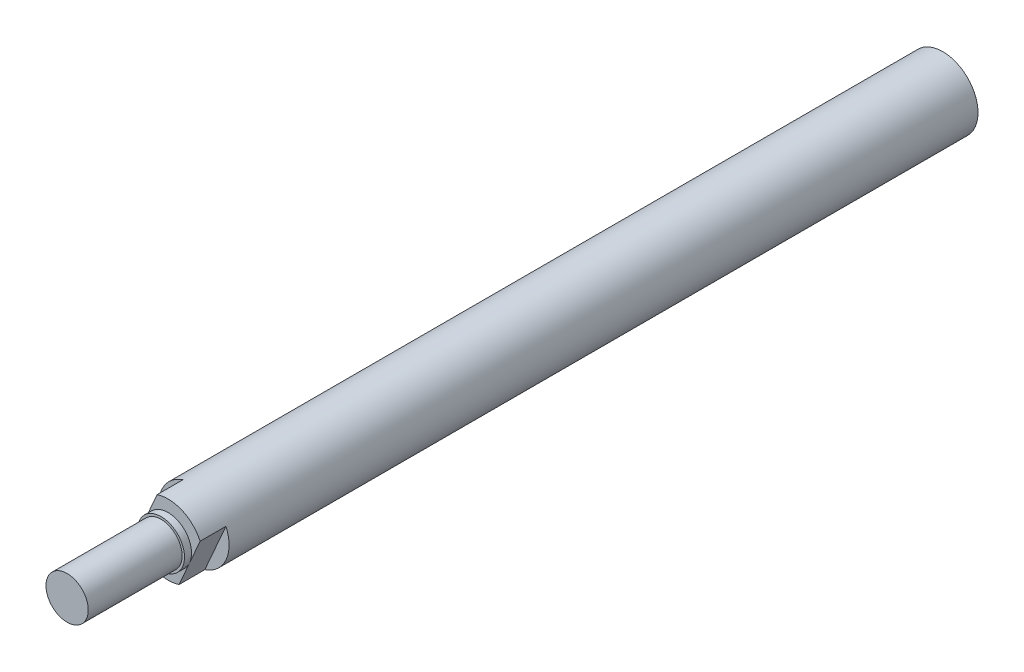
SolidWorks part; units mm, degrees
ref_plane "Plan de face" through (0, 0, 0) normal (0, 0, 1) x (1, 0, 0)
ref_plane "Plan de dessus" through (0, 0, 0) normal (0, 1, 0) x (1, 0, 0)
ref_plane "Plan de droite" through (0, 0, 0) normal (1, 0, 0) x (0, 0, -1)
imported_body "Importée1"
sketch "Esquisse1" plane through (0, 0, 202) normal (0, 0, 1) x (1, 0, 0)
  line L1 (-71.3691, 76.5989) -> (114.4064, 76.5989)
  line L2 (-71.3691, 76.5989) -> (-71.3691, -43.9193)
  line L3 (-71.3691, -43.9193) -> (114.4064, -43.9193)
  line L4 (114.4064, 76.5989) -> (114.4064, -43.9193)
extrude "Extrusion2" cut sketch "Esquisse1" against normal blind 220
sketch "Esquisse2" plane through (0, 0, 202) normal (0, 0, -1) x (-1, 0, 0)
  circle A1 centre (0, 0) radius 7.5
extrude "Extrusion3" add sketch "Esquisse2" along normal blind 150
